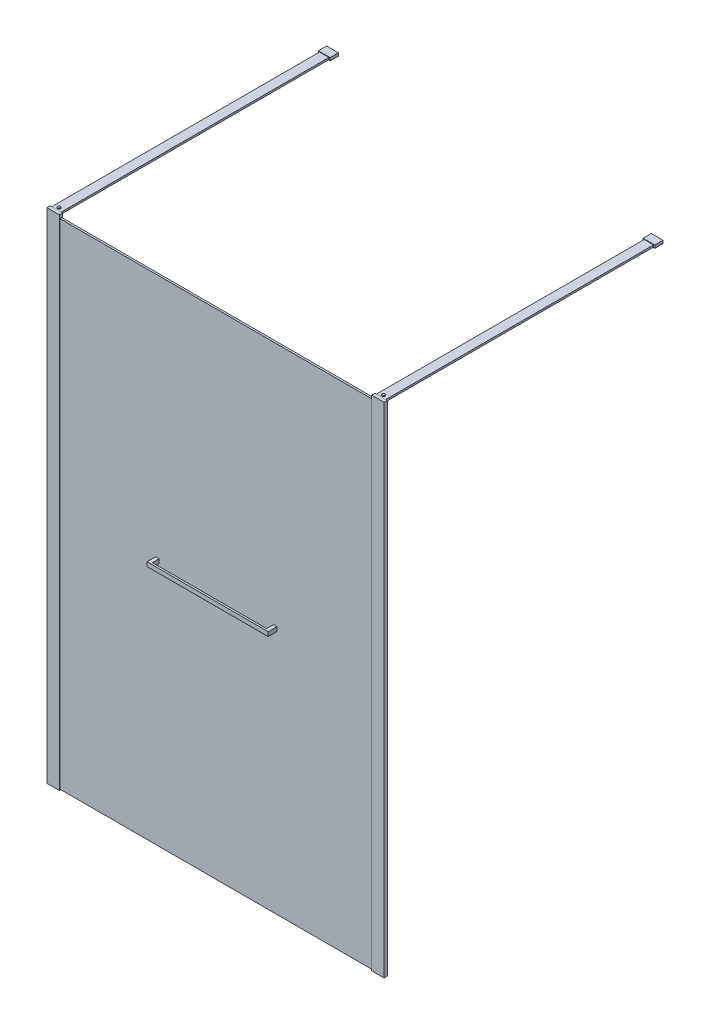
SolidWorks part; units mm, degrees
ref_plane "Płaszczyzna przednia" through (0, 0, 0) normal (0, 0, 1) x (1, 0, 0)
ref_plane "Płaszczyzna górna" through (0, 0, 0) normal (0, 1, 0) x (1, 0, 0)
ref_plane "Płaszczyzna prawa" through (0, 0, 0) normal (1, 0, 0) x (0, 0, -1)
sketch "Szkic1" plane through (0, 0, 0) normal (0, 1, 0) x (1, 0, 0)
  line L0 (0, 0) -> (0, 14)
  line L1 (0, 14) -> (53, 14)
  line L2 (53, 14) -> (53, 11)
  line L3 (53, 11) -> (42.9, 11)
  line L4 (42.9, 11) -> (42.9, 3)
  line L5 (42.9, 3) -> (53, 3)
  line L6 (53, 3) -> (53, 0)
  line L7 (53, 0) -> (0, 0)
  dimension "D1" = 53
  dimension "D2" = 14
  dimension "D3" = 10.1
  dimension "D5" = 8
extrude "Dodanie-wyciągnięcie1" add sketch "Szkic1" along normal blind 2100 from offset 3
sketch "Szkic2" plane through (0, 3, 0) normal (0, -1, 0) x (1, 0, 0)
  line L0 (42.9, -11) -> (53, -11) construction
  line L1 (42.9, -3) -> (1389.9, -3)
  line L2 (42.9, -3) -> (42.9, -11)
  line L3 (42.9, -11) -> (1389.9, -11)
  line L4 (1389.9, -3) -> (1389.9, -11)
  dimension "D1" = 1347
extrude "Dodanie-wyciągnięcie2" add sketch "Szkic2" against normal blind 2100 separate body
sketch "Szkic3" plane through (0, 3, 0) normal (0, -1, 0) x (1, 0, 0)
  line L0 (1379.8, -3) -> (1379.8, 0)
  line L1 (1389.9, -3) -> (42.9, -3) construction
  line L2 (1379.8, 0) -> (1432.8, 0)
  line L3 (1432.8, 0) -> (1432.8, -14)
  line L4 (1432.8, -14) -> (1379.8, -14)
  line L5 (1379.8, -14) -> (1379.8, -11)
  line L6 (1379.8, -11) -> (1389.9, -11)
  line L7 (1389.9, -11) -> (1389.9, -3)
  line L8 (1389.9, -3) -> (1379.8, -3)
  line L9 (42.9, -11) -> (1389.9, -11) construction
  line L10 (1389.9, -11) -> (1389.9, -3) construction
  dimension "D1" = 10.1
  dimension "D2" = 14
  dimension "D4" = 53
extrude "Dodanie-wyciągnięcie3" add sketch "Szkic3" against normal blind 2100 separate body
sketch "Szkic4" plane through (0, 2103, 0) normal (0, 1, 0) x (1, 0, 0)
  line L1 (0, 14) -> (53, 14)
  line L2 (0, 14) -> (0, 0)
  line L3 (0, 0) -> (53, 0)
  line L4 (53, 14) -> (53, 0)
extrude "Dodanie-wyciągnięcie4" add sketch "Szkic4" along normal blind 16
sketch "Szkic5" plane through (0, 2103, 0) normal (0, 1, 0) x (1, 0, 0)
  line L1 (1432.8, 14) -> (1379.8, 14)
  line L2 (1432.8, 14) -> (1432.8, 0)
  line L3 (1432.8, 0) -> (1379.8, 0)
  line L4 (1379.8, 14) -> (1379.8, 0)
extrude "Dodanie-wyciągnięcie5" add sketch "Szkic5" along normal blind 16
sketch "Szkic7" plane through (0, 3, 0) normal (0, -1, 0) x (1, 0, 0)
  line L1 (1379.8, 0) -> (1432.8, 0)
  line L2 (1379.8, 0) -> (1379.8, -14)
  line L3 (1379.8, -14) -> (1432.8, -14)
  line L4 (1432.8, 0) -> (1432.8, -14)
extrude "Dodanie-wyciągnięcie7" add sketch "Szkic7" along normal blind 3
sketch "Szkic8" plane through (0, 3, 0) normal (0, -1, 0) x (1, 0, 0)
  line L1 (0, 0) -> (53, 0)
  line L2 (0, 0) -> (0, -14)
  line L3 (0, -14) -> (53, -14)
  line L4 (53, 0) -> (53, -14)
extrude "Dodanie-wyciągnięcie8" add sketch "Szkic8" along normal blind 3
sketch "Szkic9" plane through (0, 0, -14) normal (0, 0, -1) x (-1, 0, 0)
  line L0 (-1432.8, 2119) -> (-1379.8, 2119) construction
  line L1 (-1426.3, 2119) -> (-1386.3, 2119)
  line L2 (-1426.3, 2119) -> (-1426.3, 2111)
  line L3 (-1426.3, 2111) -> (-1386.3, 2111)
  line L4 (-1386.3, 2119) -> (-1386.3, 2111)
  line L5 (-1432.8, 2119) -> (-1432.8, 0) construction
  line L6 (-1379.8, 2119) -> (-1379.8, 0) construction
  line L7 (-53, 2119) -> (-53, 0) construction
  line L8 (-46.5, 2119) -> (-6.5, 2119)
  line L9 (-46.5, 2119) -> (-46.5, 2111)
  line L10 (-46.5, 2111) -> (-6.5, 2111)
  line L11 (-6.5, 2119) -> (-6.5, 2111)
  line L12 (0, 2119) -> (0, 0) construction
  line L13 (-53, 2119) -> (0, 2119) construction
  dimension "D1" = 6.5
  dimension "D2" = 6.5
  dimension "D3" = 8
  dimension "D4" = 6.5
  dimension "D5" = 6.5
  dimension "D6" = 8
extrude "Dodanie-wyciągnięcie9" add sketch "Szkic9" along normal blind 1170 separate body
sketch "Szkic10" plane through (0, 0, -1184) normal (0, 0, -1) x (-1, 0, 0)
  line L0 (-1406.3, 2119) -> (-1406.3, 2115) construction
  line L1 (-1431.3, 2121.25) -> (-1381.3, 2121.25)
  line L2 (-1431.3, 2121.25) -> (-1431.3, 2108.75)
  line L3 (-1431.3, 2108.75) -> (-1381.3, 2108.75)
  line L4 (-1381.3, 2121.25) -> (-1381.3, 2108.75)
  line L5 (-1431.3, 2121.25) -> (-1381.3, 2108.75) construction
  line L6 (-1431.3, 2108.75) -> (-1381.3, 2121.25) construction
  line L7 (-1386.3, 2119) -> (-1426.3, 2119) construction
  line L8 (-1406.3, 2115) -> (-1426.3, 2115) construction
  line L9 (-1426.3, 2119) -> (-1426.3, 2111) construction
  line L10 (-26.5, 2119) -> (-26.5, 2115) construction
  line L11 (-51.5, 2121.25) -> (-1.5, 2121.25)
  line L12 (-51.5, 2121.25) -> (-51.5, 2108.75)
  line L13 (-51.5, 2108.75) -> (-1.5, 2108.75)
  line L14 (-1.5, 2121.25) -> (-1.5, 2108.75)
  line L15 (-51.5, 2121.25) -> (-1.5, 2108.75) construction
  line L16 (-51.5, 2108.75) -> (-1.5, 2121.25) construction
  line L17 (-6.5, 2119) -> (-46.5, 2119) construction
  line L18 (-26.5, 2115) -> (-46.5, 2115) construction
  line L19 (-46.5, 2119) -> (-46.5, 2111) construction
  point P0 (-1406.3, 2115)
  point P9 (-26.5, 2115)
  dimension "D1" = 12.5
  dimension "D2" = 50
  dimension "D3" = 12.5
  dimension "D4" = 50
extrude "Dodanie-wyciągnięcie10" add sketch "Szkic10" along normal blind 35 from offset 32
ref_plane "Płaszczyzna1" through (1406.3, 0, 0) normal (1, 0, 0) x (0, 0, -1)
sketch "Szkic11" plane through (1406.3, 0, 0) normal (1, 0, 0) x (0, 0, -1)
  line L0 (24, 2119) -> (24, 2127.4416) construction
  line L1 (24, 2119) -> (34.6926, 2119) construction
  line L2 (29.9, 2119) -> (29.65, 2122.8)
  line L3 (24, 2124.7) -> (30.2413, 2124.7) construction
  line L4 (24, 2124.7) -> (24, 2124.2)
  line L5 (1152, 2119) -> (14, 2119) construction
  line L6 (14, 2119) -> (14, 2111) construction
  line L7 (29.3989, 2119) -> (29.9, 2119)
  line L9 (29.1663, 2122.5357) -> (29.3989, 2119)
  arc A0 (24, 2124.7) -> (29.65, 2122.8) centre (24, 2115.3493) cw
  arc A1 (29.1663, 2122.5357) -> (24, 2124.2) centre (24, 2115.3493) ccw
  dimension "D1" = 0.5
  dimension "D2" = 11.3
  dimension "D3" = 5.7
  dimension "D4" = 3.8
  dimension "D5" = 11.8
  dimension "D6" = 0.5
  dimension "D7" = 10
revolve "Obrót1" add sketch "Szkic11" angle 360 about L0
ref_plane "Płaszczyzna2" through (26.5, 0, 0) normal (1, 0, 0) x (0, 0, -1)
sketch "Szkic14" plane through (26.5, 0, 0) normal (1, 0, 0) x (0, 0, -1)
  line L0 (24, 2119) -> (24, 2141.8878) construction
  line L1 (24, 2119) -> (23.0807, 2119) construction
  line L2 (29.9, 2119) -> (29.65, 2122.8)
  line L3 (24, 2124.7) -> (18.6294, 2124.7) construction
  line L4 (24, 2124.7) -> (24, 2124.2)
  line L5 (29.3989, 2119) -> (29.9, 2119)
  line L6 (29.1663, 2122.5357) -> (29.3989, 2119)
  line L7 (1152, 2119) -> (14, 2119) construction
  line L8 (14, 2119) -> (14, 2111) construction
  arc A0 (24, 2124.7) -> (29.65, 2122.8) centre (24, 2115.3493) cw
  arc A1 (29.1663, 2122.5357) -> (24, 2124.2) centre (24, 2115.3493) ccw
  dimension "D1" = 5.7
  dimension "D2" = 3.8
  dimension "D3" = 0.5
  dimension "D4" = 0.5
  dimension "D5" = 11.3
  dimension "D6" = 11.8
  dimension "D7" = 10
revolve "Obrót2" add sketch "Szkic14" angle 360 about L0
sketch "Szkic12" plane through (0, 0, -3) normal (0, 0, 1) x (1, 0, 0)
  line L0 (716.4, 1409.7928) -> (716.4, 762.3594) construction
  line L1 (466.4, 1053) -> (966.4, 1053) construction
  line L2 (42.9, 2103) -> (42.9, 3) construction
  line L3 (1389.9, 2103) -> (1389.9, 3) construction
  line L5 (458.9, 1062) -> (473.9, 1062)
  line L6 (458.9, 1062) -> (458.9, 1044)
  line L7 (458.9, 1044) -> (473.9, 1044)
  line L8 (473.9, 1062) -> (473.9, 1044)
  line L9 (458.9, 1062) -> (473.9, 1044) construction
  line L10 (458.9, 1044) -> (473.9, 1062) construction
  line L11 (958.9, 1062) -> (973.9, 1062)
  line L12 (958.9, 1062) -> (958.9, 1044)
  line L13 (958.9, 1044) -> (973.9, 1044)
  line L14 (973.9, 1062) -> (973.9, 1044)
  line L15 (958.9, 1062) -> (973.9, 1044) construction
  line L16 (958.9, 1044) -> (973.9, 1062) construction
  dimension "D1" = 1053
  dimension "D2" = 500
  dimension "D3" = 15
  dimension "D4" = 18
extrude "Dodanie-wyciągnięcie11" add sketch "Szkic12" along normal blind 36.5 and the other way blind 18 separate body
sketch "Szkic13" plane through (473.9, 0, 0) normal (1, 0, 0) x (0, 0, -1)
  line L0 (21, 1044) -> (-33.5, 1044) construction
  line L1 (-33.5, 1062) -> (-25.5, 1062)
  line L2 (-33.5, 1062) -> (-33.5, 1044)
  line L3 (-33.5, 1044) -> (-25.5, 1044)
  line L4 (-25.5, 1062) -> (-25.5, 1044)
  dimension "D1" = 8
extrude "Dodanie-wyciągnięcie12" add sketch "Szkic13" along normal up to surface (485 mm away)
